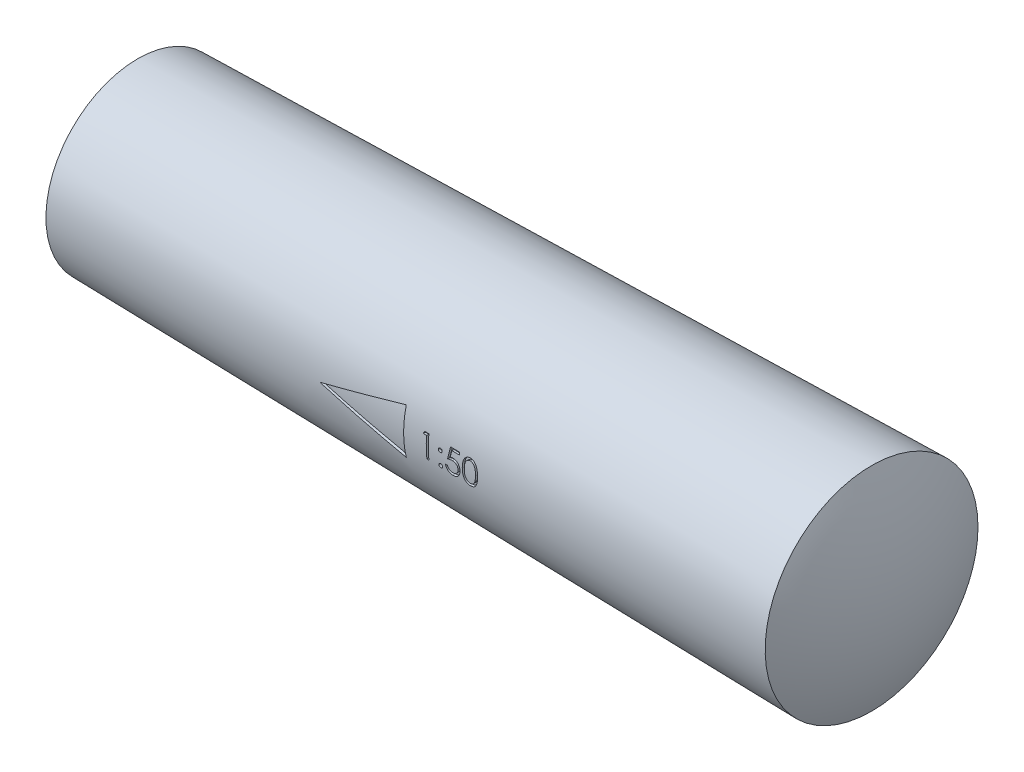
SolidWorks part; units mm, degrees
ref_plane "Front Plane" through (0, 0, 0) normal (0, 0, 1) x (1, 0, 0)
ref_plane "Top Plane" through (0, 0, 0) normal (0, 1, 0) x (1, 0, 0)
ref_plane "Right Plane" through (0, 0, 0) normal (1, 0, 0) x (0, 0, -1)
sketch "Sketch1" plane through (0, 0, 0) normal (1, 0, 0) x (0, 0, -1)
  circle A0 centre (0, 0) radius 4
  dimension "D1" = 8
extrude "Extrude1" add sketch "Sketch1" along normal mid plane 32
draft "Draft1" type of draft neutral plane draft angle 1.146 faces to draft 1 parameters "D1"=1.146
sketch "Sketch2" plane through (0, 0, 0) normal (0, 0, 1) x (1, 0, 0)
  line L0 (-16, 0) -> (-16, 4)
  line L1 (-16, 4) -> (-16, -4) construction
  line L2 (-16, 0) -> (-17, 0)
  line L3 (-17, 0) -> (-17, -4.32) construction
  line L4 (16, 0) -> (16, 4.64)
  line L5 (16, -4.64) -> (16, 4.64) construction
  line L6 (16, 0) -> (17, 0)
  line L7 (17, 0) -> (17, -4.32) construction
  line L8 (-16, -4) -> (16, -4.64) construction
  arc A0 (-17, 0) -> (-16, 4) centre (-8.5, 0) cw
  arc A1 (17, 0) -> (16, 4.64) centre (5.7351, 0) ccw
  point P14 (0, -4.32)
revolve "Revolve1" add sketch "Sketch2" angle 360 about L2
sketch "Sketch5" plane through (0, 0, 0) normal (0, 0, 1) x (1, 0, 0)
  line L0 (0, 4.32) -> (0, -4.32) construction
  line L1 (16, 4.64) -> (-16, 4) construction
  line L2 (-16, -4) -> (16, -4.64) construction
ref_plane "Plane2" through (0, 0, 0) normal (-0.02, 0, 0.9998) x (0.9998, 0, 0.02)
sketch "Sketch6" plane through (0, 0, 0) normal (-0.02, 0, 0.9998) x (0.9998, 0, 0.02)
  line L0 (0, 0) -> (0, 1)
  line L1 (0, 4.32) -> (0, -4.32) construction
  line L2 (0, 1) -> (-3.7321, 0)
  line L3 (-3.7321, 0) -> (0, -1)
  line L4 (0, -1) -> (0, 0)
  line L5 (0, -0.5) -> (4, -0.5) construction
  text T0 "1:50" font "Century Gothic" height 1
  dimension "D1" = 2
  dimension "D2" = 30
  dimension "D3" = 4
wrap "Wrap2" sketch "Sketch6" wrap type deboss source sketch "Sketch6" thickness 0.1 parameters "D1"=0.1
equation "\"D2@Sketch2\" = \"D1@Sketch2\""
